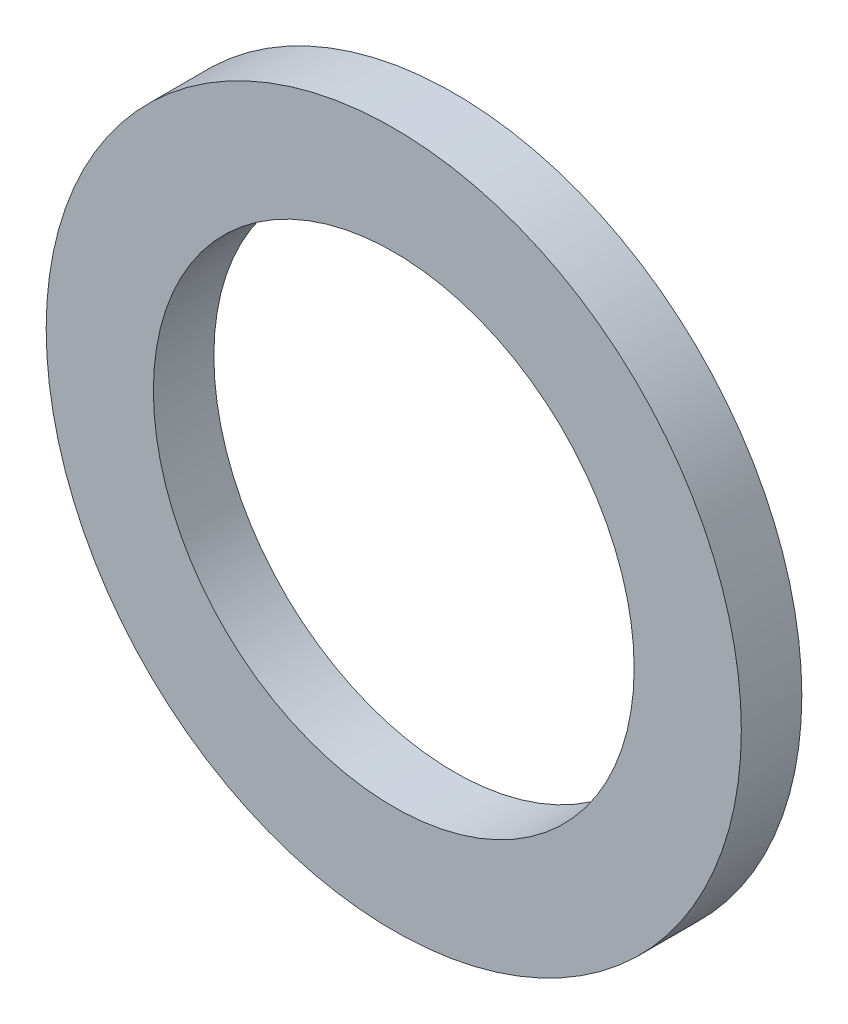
SolidWorks part; units mm, degrees
ref_plane "前视基准面" through (0, 0, 0) normal (0, 0, 1) x (1, 0, 0)
ref_plane "上视基准面" through (0, 0, 0) normal (0, 1, 0) x (1, 0, 0)
ref_plane "右视基准面" through (0, 0, 0) normal (1, 0, 0) x (0, 0, -1)
sketch "草图1" plane through (0, 0, 0) normal (0, 0, 1) x (1, 0, 0)
  circle A0 centre (0, 0) radius 4.54
  circle A1 centre (0, 0) radius 3.14
  dimension "D1" = 6.28
  dimension "D2" = 9.08
extrude "凸台-拉伸1" add sketch "草图1" along normal blind 0.79
